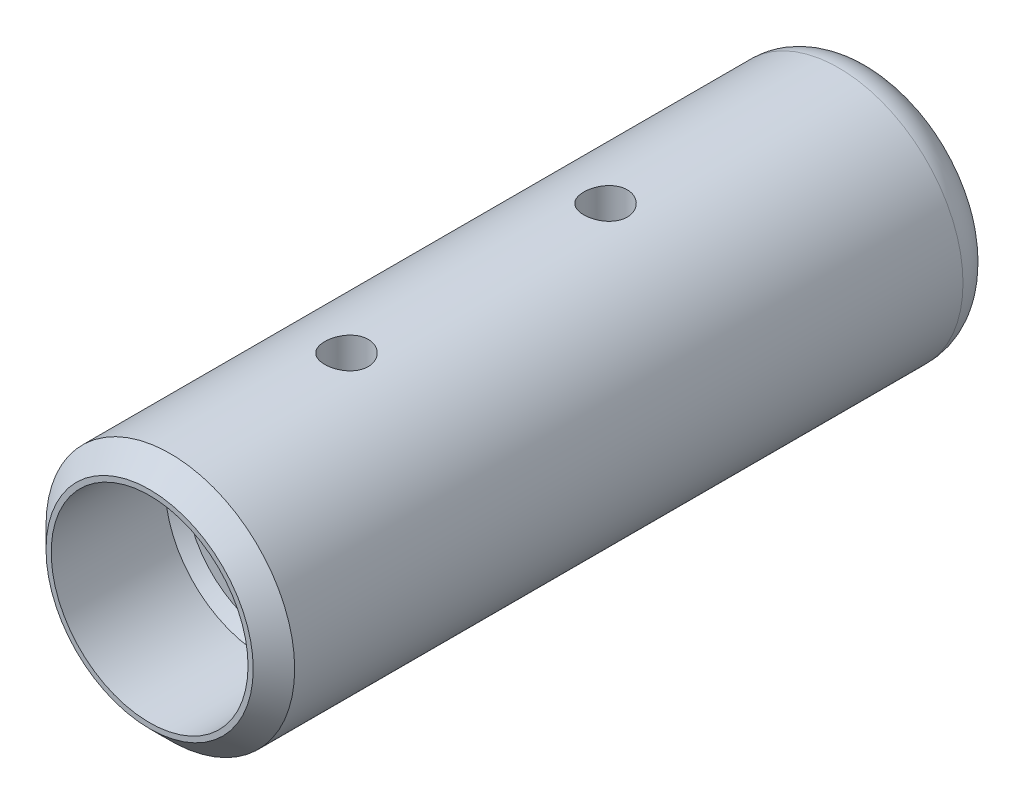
SolidWorks part; units mm, degrees
ref_plane "Face" through (0, 0, 0) normal (0, 0, 1) x (1, 0, 0)
ref_plane "Dessus" through (0, 0, 0) normal (0, 1, 0) x (1, 0, 0)
ref_plane "Droite" through (0, 0, 0) normal (1, 0, 0) x (0, 0, -1)
sketch "Esquisse1" plane through (0, 0, 0) normal (0, 0, 1) x (1, 0, 0)
  circle A0 centre (0, 0) radius 12
  dimension "D1" = 24
extrude "Base-Extrusion" add sketch "Esquisse1" along normal blind 70
chamfer "Chanfrein1" [suppressed] distance 2 distance2 4
chamfer "Chanfrein2" distance 2 angle 45 1 edges at (12, 0, 70)
sketch "Esquisse2" plane through (0, 0, 70) normal (0, 0, 1) x (1, 0, 0)
  circle A0 centre (0, 0) radius 9.5
  dimension "D1" = 19
extrude "Enlèv. mat.-Extru.1" cut sketch "Esquisse2" against normal blind 12
chamfer "Chanfrein3" distance 1 angle 45 1 edges at (9.5, 0, 58)
hole_wizard "Diamètre du perçage Ø8.5 (8.5)1" positions "Esquisse5" profile "Esquisse4" hole size "Ø8.5" standard "ISO"
sketch "Esquisse5" plane through (0, 0, 58) normal (0, 0, 1) x (1, 0, 0)
  circle A0 centre (0, 0) radius 8.5 construction
  point P0 (0, 0)
sketch "Esquisse4" plane through (0, 0, 58) normal (1, 0, 0) x (0, -1, 0)
  line L0 (0, 0) -> (0, 42.5537)
  line L1 (0, 42.5537) -> (4.25, 40)
  line L2 (4.25, 40) -> (4.25, 0)
  line L5 (4.25, 0) -> (0, 0)
  line L10 (0, 42.5537) -> (-4.25, 40) construction
  line L11 (0, -6.35) -> (0, 107.95) construction
  dimension "Diamètre du perçage" = 8.5
  dimension "Profondeur du perçage" = 40
  dimension "Angle de pointe" = 118
thread "Filetage1" pitch 1.5 start angle 0, offset 5, length 40, pitch 1.5, diameter 8.5
ref_plane "Plan2" through (-4.25, 0, 63) normal (0, -1, 0) x (-1, 0, 0)
sketch "Profil de filetage1" plane through (-4.25, 0, 63) normal (0, -1, 0) x (-1, 0, 0)
  line L0 (0, 0) -> (0, 1.5) construction
  line L1 (0, 0) -> (0.8119, 0.4687)
  line L2 (0.8119, 0.4687) -> (0.8119, 0.6562)
  line L3 (0.8119, 0.6562) -> (0, 1.125)
  line L4 (0.8119, 0.5625) -> (0, 0.5625) construction
  line L11 (0, 0) -> (0, 1.125)
  point P2 (0, 0)
  dimension "Pitch" = 1.5
  dimension "Profile_Angle" = 60
  dimension "Profile_Land" = 0.1875
  dimension "Profile_Height" = 0.8119
ref_plane "Plan1" through (0, 12, 0) normal (0, 1, 0) x (-1, 0, 0)
sketch "Esquisse6" plane through (0, 12, 0) normal (0, 1, 0) x (-1, 0, 0)
  line L0 (0, 68) -> (0, 0) construction
  line L1 (10, 70) -> (-10, 70) construction
  circle A0 centre (0, 26) radius 2.1
  circle A1 centre (0, 51) radius 2.1
  dimension "D3" = 4.2
  dimension "D4" = 4.2
  dimension "D1" = 19
  dimension "D2" = 25
extrude "Enlèv. mat.-Extru.2" cut sketch "Esquisse6" against normal up to next
fillet "Congé1" radius 3.5 1 edges at (12, 0, 0)
sketch "Esquisse10" plane through (0, 12, 0) normal (0, 1, 0) x (-1, 0, 0)
  line L1 (-6.0235, 56.7164) -> (5.9179, 56.7164)
  line L2 (-6.0235, 56.7164) -> (-6.0235, 20.0469)
  line L3 (-6.0235, 20.0469) -> (5.9179, 20.0469)
  line L4 (5.9179, 56.7164) -> (5.9179, 20.0469)
  circle A0 centre (0, 51) radius 2.1 construction
  circle A1 centre (0, 51) radius 2.1
  circle A2 centre (0, 26) radius 2.1 construction
  circle A3 centre (0, 26) radius 2.1
extrude "Boss.-Extru.1" add sketch "Esquisse10" against normal up to surface
thread "Filetage2" pitch 0.8 start angle 0, offset 5, length 15, pitch 0.8, diameter 4.2
ref_plane "Plan3" through (-2.1, 17, 51) normal (0, 0, 1) x (-1, 0, 0)
sketch "Profil de filetage2" plane through (-2.1, 17, 51) normal (0, 0, 1) x (-1, 0, 0)
  line L0 (0, 0) -> (0, 0.8) construction
  line L1 (0, 0) -> (0.433, 0.25)
  line L2 (0.433, 0.25) -> (0.433, 0.35)
  line L3 (0.433, 0.35) -> (0, 0.6)
  line L4 (0.433, 0.3) -> (0, 0.3) construction
  line L11 (0, 0) -> (0, 0.6)
  point P2 (0, 0)
  dimension "Pitch" = 0.8
  dimension "Profile_Angle" = 60
  dimension "Profile_Land" = 0.1
  dimension "Profile_Height" = 0.433
thread "Filetage3" pitch 0.8 start angle 0, offset 5, length 15, pitch 0.8, diameter 4.2
ref_plane "Plan4" through (-2.1, 17, 26) normal (0, 0, 1) x (-1, 0, 0)
sketch "Profil de filetage3" plane through (-2.1, 17, 26) normal (0, 0, 1) x (-1, 0, 0)
  line L0 (0, 0) -> (0, 0.8) construction
  line L1 (0, 0) -> (0.433, 0.25)
  line L2 (0.433, 0.25) -> (0.433, 0.35)
  line L3 (0.433, 0.35) -> (0, 0.6)
  line L4 (0.433, 0.3) -> (0, 0.3) construction
  line L11 (0, 0) -> (0, 0.6)
  point P2 (0, 0)
  dimension "Pitch" = 0.8
  dimension "Profile_Angle" = 60
  dimension "Profile_Land" = 0.1
  dimension "Profile_Height" = 0.433
sketch "Esquisse16" plane through (0, 0, 0) normal (0, 0, -1) x (-1, 0, 0)
  circle A0 centre (0, 0) radius 12 construction
  circle A1 centre (0, 0) radius 12
  circle A2 centre (0, 0) radius 19.9185
extrude "Enlèv. mat.-Extru.3" cut sketch "Esquisse16" against normal through all
